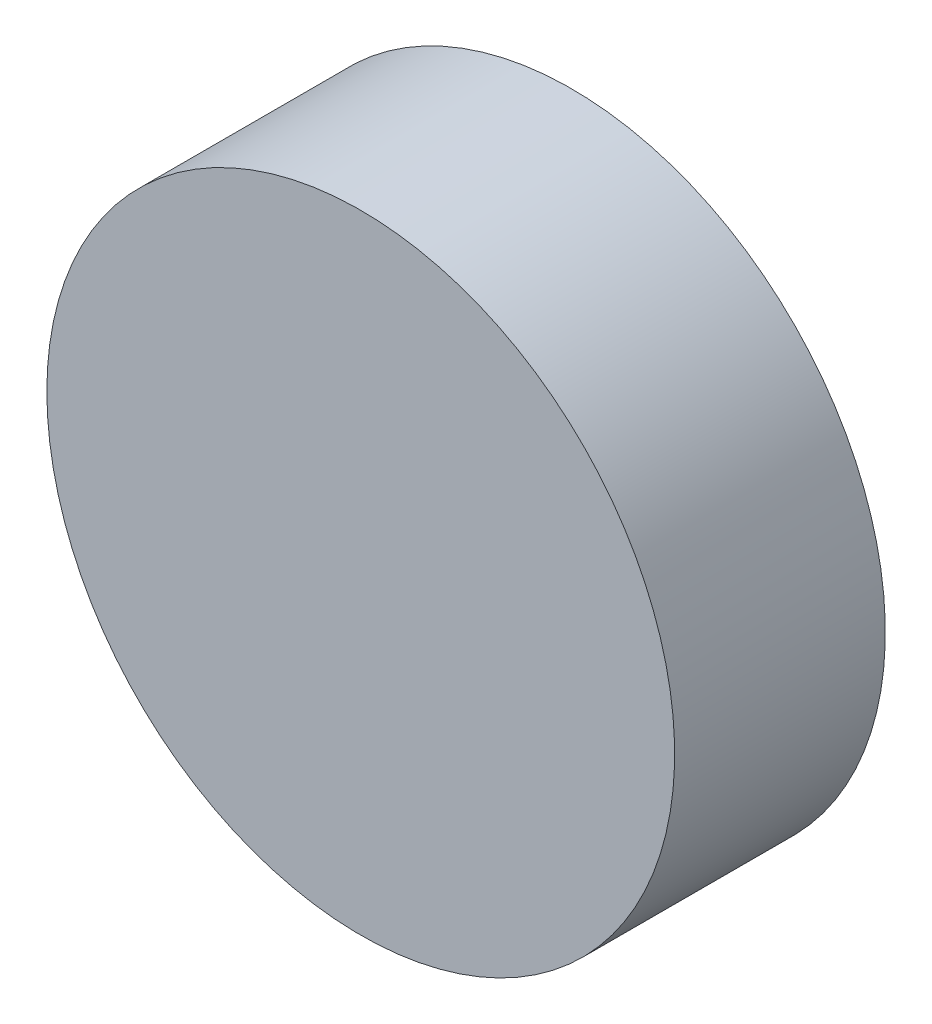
SolidWorks part; units mm, degrees
ref_plane "Front" through (0, 0, 0) normal (0, 0, 1) x (1, 0, 0)
ref_plane "Top" through (0, 0, 0) normal (0, 1, 0) x (1, 0, 0)
ref_plane "Right" through (0, 0, 0) normal (1, 0, 0) x (0, 0, -1)
sketch "Sketch1" plane through (0, 0, 0) normal (0, 0, 1) x (1, 0, 0)
  circle A0 centre (0, 0) radius 28.575
  dimension "D1" = 57.15
extrude "Boss-Extrude1" add sketch "Sketch1" along normal blind 19.177
